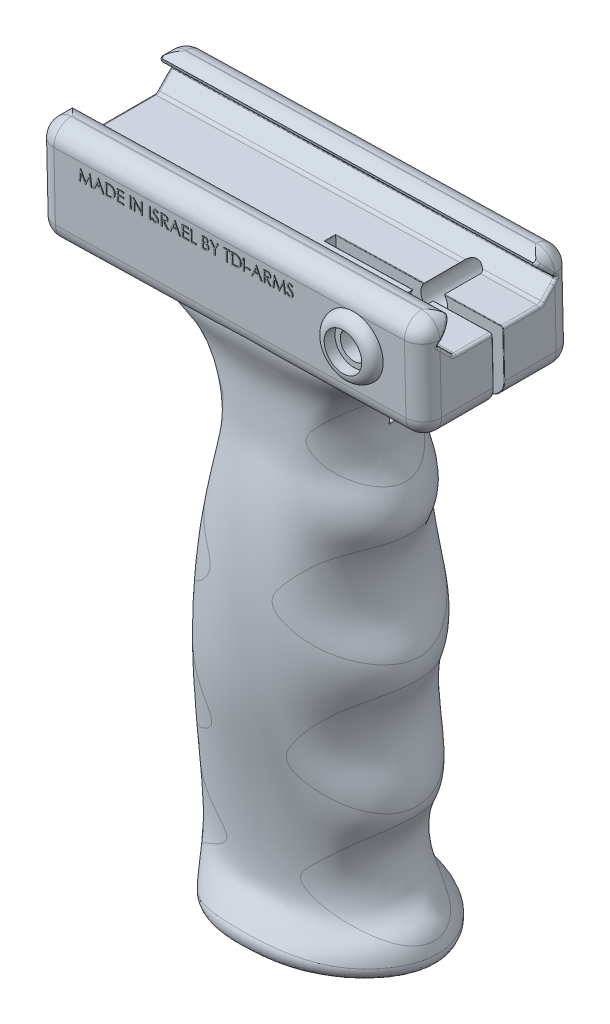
SolidWorks part; units mm, degrees
ref_plane "Front Plane" through (0, 0, 0) normal (0, 0, 1) x (1, 0, 0)
ref_plane "Top Plane" through (0, 0, 0) normal (0, 1, 0) x (1, 0, 0)
ref_plane "Right Plane" through (0, 0, 0) normal (1, 0, 0) x (0, 0, -1)
body saved out of another part "Stock-TDI ARMS IDIT-1"
sketch "Sketch1" plane through (-0.3098, 13.308, 0) normal (-0.0233, 0.9997, 0) x (0.9997, 0.0233, 0)
  line L0 (200.0133, -7.7141) -> (200.0133, 7.772) construction
  line L1 (183.5574, -0.9711) -> (216.4691, -0.9711)
  line L2 (183.5574, -0.9711) -> (183.5574, 1.0289)
  line L3 (183.5574, 1.0289) -> (216.4691, 1.0289)
  line L4 (216.4691, -0.9711) -> (216.4691, 1.0289)
  line L5 (183.5574, -0.9711) -> (216.4691, 1.0289) construction
  line L6 (183.5574, 1.0289) -> (216.4691, -0.9711) construction
  point P0 (200.0133, 0.0289)
extrude "Cut-Extrude1" cut sketch "Sketch1" against normal blind 23.7
fillet "Fillet1" radius 0.1 18 edges at (213.7285, 7.2933, -1.0289) (214.5455, 13.7278, -1.0289) (214.2959, 18.1571, -1.0289) (213.7285, 7.2933, 0.9711) (214.5455, 13.7278, 0.9711) (214.2959, 18.1571, 0.9711) (195.8085, -2.3677, -1.0289) (201.203, 4.1711, -1.0289) (202.4019, 4.7924, 0.9711) (195.7726, -2.4961, 0.9711) (191.4236, 17.7712, -1.0289) (208.6912, 18.1732, -1.0289) (208.6912, 18.1732, 0.9711) (191.4236, 17.7712, 0.9711) (183.1979, 17.5797, -0.0289)
